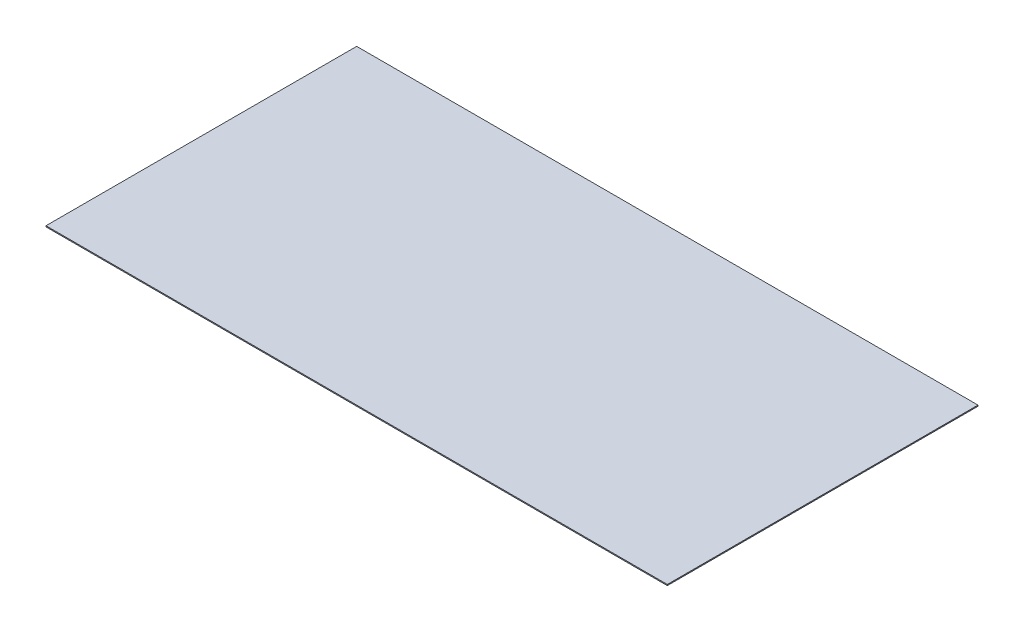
SolidWorks part; units mm, degrees
ref_plane "Front Plane" through (0, 0, 0) normal (0, 0, 1) x (1, 0, 0)
ref_plane "Top Plane" through (0, 0, 0) normal (0, 1, 0) x (1, 0, 0)
ref_plane "Right Plane" through (0, 0, 0) normal (1, 0, 0) x (0, 0, -1)
sketch "Sketch1" plane through (0, 0, 0) normal (0, 1, 0) x (1, 0, 0)
  line L1 (0, 0) -> (914.4, 0)
  line L2 (0, 0) -> (0, 457.2)
  line L3 (0, 457.2) -> (914.4, 457.2)
  line L4 (914.4, 0) -> (914.4, 457.2)
extrude "Boss-Extrude1" add sketch "Sketch1" along normal blind 1.524
